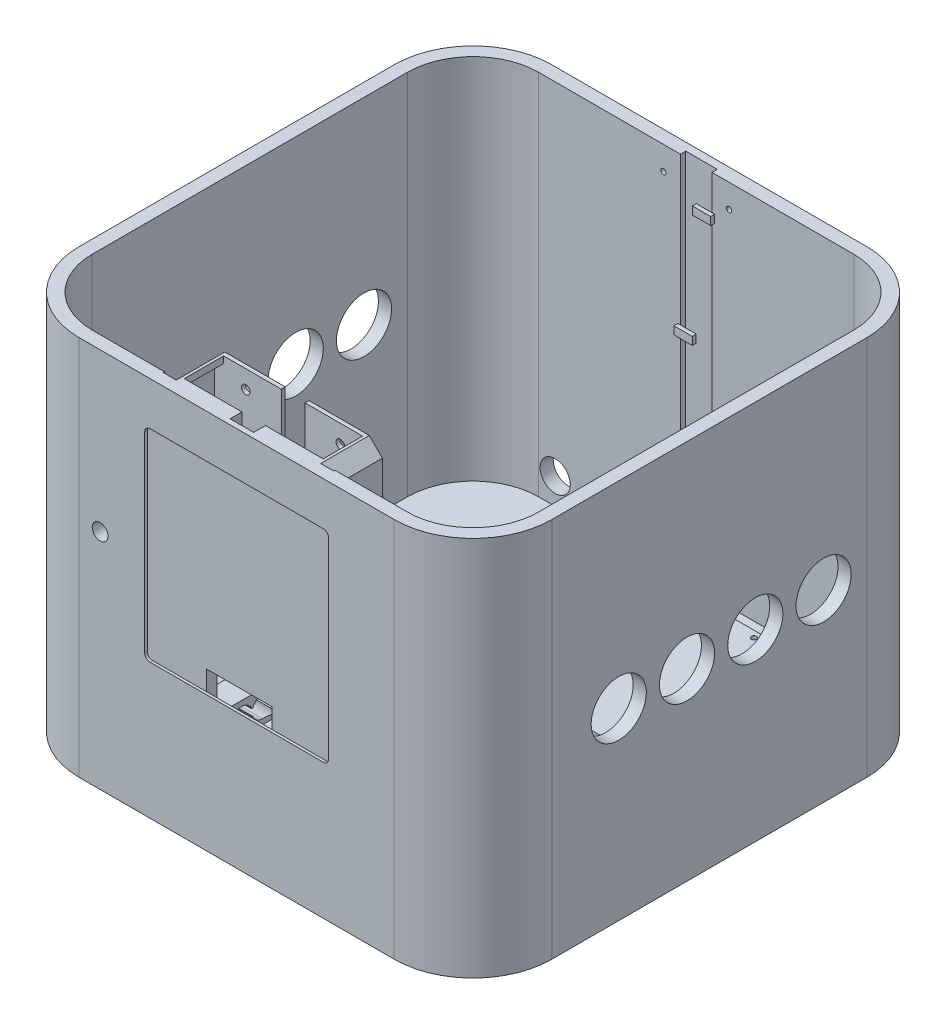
SolidWorks part; units mm, degrees
ref_plane "前视基准面" through (0, 0, 0) normal (0, 0, 1) x (1, 0, 0)
ref_plane "上视基准面" through (0, 0, 0) normal (0, 1, 0) x (1, 0, 0)
ref_plane "右视基准面" through (0, 0, 0) normal (1, 0, 0) x (0, 0, -1)
sketch "草图1" plane through (0, 0, 0) normal (0, 1, 0) x (1, 0, 0)
  line L1 (-90, -90) -> (90, -90)
  line L2 (-90, -90) -> (-90, 90)
  line L3 (-90, 90) -> (90, 90)
  line L4 (90, -90) -> (90, 90)
  line L5 (-90, -90) -> (90, 90) construction
  line L6 (-90, 90) -> (90, -90) construction
  point P0 (0, 0)
  dimension "D1" = 180
  dimension "D2" = 180
extrude "凸台-拉伸1" add sketch "草图1" along normal blind 180
fillet "圆角1" radius 30 4 edges at (90, 90, -90) (90, 90, 90) (-90, 90, 90) (-90, 90, -90)
sketch "草图2" plane through (0, 0, 0) normal (1, 0, 0) x (0, 0, -1)
  line L0 (-111.4699, 145) -> (109.0676, 145)
  line L1 (-60, 180) -> (60, 180) construction
  dimension "D1" = 35
surface "曲面-拉伸1" sketch "草图2" parameters "D1"=308
other "使用曲面切除1"
shell "抽壳2" thickness 5
sketch "草图3" plane through (0, 5, 0) normal (0, 1, 0) x (1, 0, 0)
  line L0 (-6.5, 85) -> (6.5, 85)
  line L1 (-6.5, 85) -> (-6.5, 60)
  line L2 (6.5, 85) -> (6.5, 60)
  line L3 (-6.5, 60) -> (6.5, 60)
  line L4 (60, 85) -> (-60, 85) construction
  point P6 (0, 85)
  dimension "D1" = 13
  dimension "D2" = 25
extrude "凸台-拉伸2" add sketch "草图3" along normal blind 3.5
sketch "草图4" plane through (0, 8.5, 0) normal (0, 1, 0) x (1, 0, 0)
  line L0 (0, -1000) -> (0, 49000) construction
  line L1 (6.5, 85) -> (-6.5, 85) construction
  circle A0 centre (0, 79.5) radius 2.75
  circle A1 centre (0, 64.5) radius 2.75
  dimension "D1" = 5.5
  dimension "D2" = 15
  dimension "D3" = 5.5
extrude "切除-拉伸1" cut sketch "草图4" against normal up to next
sketch "草图5" plane through (0, 0, 0) normal (0, -1, 0) x (1, 0, 0)
  line L0 (0, -1000) -> (0, 49000) construction
  line L13 (4.3301, -67) -> (4.3301, -62)
  line L14 (4.3301, -62) -> (0, -59.5)
  line L15 (0, -59.5) -> (-4.3301, -62)
  line L16 (-4.3301, -62) -> (-4.3301, -67)
  line L17 (-4.3301, -67) -> (0, -69.5)
  line L18 (0, -69.5) -> (4.3301, -67)
  line L19 (4.3301, -82) -> (4.3301, -77)
  line L20 (4.3301, -77) -> (0, -74.5)
  line L21 (0, -74.5) -> (-4.3301, -77)
  line L22 (-4.3301, -77) -> (-4.3301, -82)
  line L23 (-4.3301, -82) -> (0, -84.5)
  line L24 (0, -84.5) -> (4.3301, -82)
  circle A0 centre (0, -64.5) radius 5 construction
  circle A1 centre (0, -79.5) radius 5 construction
  dimension "D1" = 10
  dimension "D2" = 10
extrude "切除-拉伸2" cut sketch "草图5" against normal blind 4
sketch "草图6" plane through (0, 5, 0) normal (0, 1, 0) x (1, 0, 0)
  line L0 (11.5, 80) -> (64.5, 80) construction
  line L1 (11.5, 80) -> (11.5, 11) construction
  line L2 (64.5, 80) -> (64.5, 11) construction
  line L3 (11.5, 11) -> (64.5, 11) construction
  line L5 (6.5, 60) -> (6.5, 85) construction
  line L7 (-60, 85) -> (60, 85) construction
  circle A0 centre (29.5, 77.5) radius 1
  circle A1 centre (57, 77.5) radius 1
  circle A2 centre (62, 25) radius 1
  dimension "D5" = 2
  dimension "D1" = 53
  dimension "D2" = 69
  dimension "D3" = 5
  dimension "D4" = 2.5
  dimension "D6" = 2.5
  dimension "D7" = 18
  dimension "D8" = 27.5
  dimension "D9" = 14
  dimension "D10" = 5
sketch "草图7" plane through (0, 5, 0) normal (0, 1, 0) x (1, 0, 0)
  line L0 (11.5, 80) -> (64.5, 80)
  line L1 (11.5, 80) -> (11.5, 16.0952)
  line L2 (64.5, 80) -> (64.5, 16.0952)
  line L3 (11.5, 16.0952) -> (64.5, 16.0952)
extrude "凸台-拉伸3" add sketch "草图7" along normal blind 2
extrude "切除-拉伸6" cut sketch "草图6" along normal up to surface (2 mm away) and the other way blind 3
sketch "草图8" plane through (0, 8.5, 0) normal (0, 1, 0) x (1, 0, 0)
  line L0 (-6.5, 85) -> (6.5, 85)
  line L1 (-6.5, 85) -> (-6.5, 82.5)
  line L2 (6.5, 85) -> (6.5, 82.5)
  line L3 (-6.5, 82.5) -> (6.5, 82.5)
  dimension "D1" = 2.5
extrude "切除-拉伸7" cut sketch "草图8" against normal up to surface (3.5 mm away)
sketch "草图9" plane through (0, 5, 0) normal (0, 1, 0) x (1, 0, 0)
  line L0 (-49.5, 80) -> (-11.5, 80)
  line L1 (-49.5, 80) -> (-49.5, 45)
  line L2 (-11.5, 80) -> (-11.5, 45)
  line L3 (-49.5, 45) -> (-11.5, 45)
  line L4 (-60, 85) -> (60, 85) construction
  line L5 (-6.5, 82.5) -> (-6.5, 60) construction
  dimension "D3" = 5
  dimension "D1" = 38
  dimension "D2" = 35
  dimension "D4" = 5
extrude "凸台-拉伸5" add sketch "草图9" along normal blind 2
sketch "草图10" plane through (0, 7, 0) normal (0, 1, 0) x (1, 0, 0)
  line L0 (-49.5, 80) -> (-11.5, 45) construction
  line L1 (-11.5, 80) -> (-49.5, 45) construction
  line L3 (-45.5, 75) -> (-15.5, 75) construction
  line L4 (-45.5, 75) -> (-45.5, 50) construction
  line L5 (-45.5, 50) -> (-15.5, 50) construction
  line L6 (-15.5, 75) -> (-15.5, 50) construction
  line L7 (-45.5, 75) -> (-15.5, 50) construction
  line L8 (-45.5, 50) -> (-15.5, 75) construction
  circle A0 centre (-45.5, 75) radius 1
  circle A1 centre (-15.5, 75) radius 1
  circle A2 centre (-45.5, 50) radius 1
  circle A3 centre (-15.5, 50) radius 1
  point P8 (-30.5, 62.5)
  dimension "D3" = 2
  dimension "D1" = 30
  dimension "D2" = 25
extrude "切除-拉伸8" cut sketch "草图10" against normal blind 5
sketch "草图11" plane through (0, 5, 0) normal (0, 1, 0) x (1, 0, 0)
  line L0 (-49.5, 45) -> (-11.5, 45) construction
  line L1 (-44.5, 40) -> (-11.5, 40)
  line L2 (-44.5, 40) -> (-44.5, 2)
  line L3 (-44.5, 2) -> (-11.5, 2)
  line L4 (-11.5, 40) -> (-11.5, 2)
  line L5 (-44.5, 40) -> (-11.5, 2) construction
  line L6 (-44.5, 2) -> (-11.5, 40) construction
  line L7 (-49.5, 45) -> (-11.5, 45) construction
  line L8 (-11.5, 45) -> (-11.5, 80) construction
  point P0 (-28, 21)
  point P10 (-30.5, 45)
  dimension "D1" = 38
  dimension "D2" = 33
  dimension "D3" = 5
extrude "凸台-拉伸6" add sketch "草图11" along normal blind 2
sketch "草图12" plane through (0, 7, 0) normal (0, 1, 0) x (1, 0, 0)
  line L0 (-44.5, 40) -> (-11.5, 2) construction
  line L1 (-44.5, 2) -> (-11.5, 40) construction
  line L3 (-40.5, 36) -> (-15.5, 36) construction
  line L4 (-40.5, 36) -> (-40.5, 6) construction
  line L5 (-40.5, 6) -> (-15.5, 6) construction
  line L6 (-15.5, 36) -> (-15.5, 6) construction
  line L7 (-40.5, 36) -> (-15.5, 6) construction
  line L8 (-40.5, 6) -> (-15.5, 36) construction
  circle A0 centre (-40.5, 36) radius 1
  circle A1 centre (-15.5, 36) radius 1
  circle A2 centre (-15.5, 6) radius 1
  circle A3 centre (-40.5, 6) radius 1
  point P8 (-28, 21)
  dimension "D3" = 2
  dimension "D1" = 30
  dimension "D2" = 25
extrude "切除-拉伸9" cut sketch "草图12" against normal blind 5
sketch "草图13" plane through (0, 5, 0) normal (0, 1, 0) x (1, 0, 0)
  line L0 (-11.5, 40) -> (-44.5, 40) construction
  line L1 (-81.5, 40) -> (-49.5, 40)
  line L2 (-81.5, 40) -> (-81.5, 4)
  line L3 (-81.5, 4) -> (-49.5, 4)
  line L4 (-49.5, 40) -> (-49.5, 4)
  line L5 (-81.5, 40) -> (-49.5, 4) construction
  line L6 (-81.5, 4) -> (-49.5, 40) construction
  line L7 (-44.5, 40) -> (-44.5, 2) construction
  point P0 (-65.5, 22)
  dimension "D1" = 32
  dimension "D2" = 36
  dimension "D3" = 5
extrude "凸台-拉伸7" add sketch "草图13" along normal blind 2
sketch "草图14" plane through (0, 7, 0) normal (0, 1, 0) x (1, 0, 0)
  line L0 (-49.5, 40) -> (-81.5, 40) construction
  line L1 (-65.5, -960) -> (-65.5, 49040) construction
  line L2 (-49.5, 40) -> (-81.5, 40) construction
  circle A0 centre (-78, 36) radius 1
  circle A1 centre (-53, 36) radius 1
  point P12 (-65.5, 40)
  dimension "D1" = 2
  dimension "D2" = 2
  dimension "D3" = 4
  dimension "D4" = 25
  dimension "D5" = 12.5
extrude "切除-拉伸10" cut sketch "草图14" against normal blind 5
sketch "草图15" plane through (0, 0, 85) normal (0, 0, -1) x (-1, 0, 0)
  line L0 (-32.5, 145) -> (32.5, 145)
  line L1 (-32.5, 145) -> (-32.5, 70)
  line L2 (32.5, 145) -> (32.5, 70)
  line L3 (-32.5, 70) -> (32.5, 70)
  line L4 (60, 145) -> (-60, 145) construction
  point P6 (0, 145)
  dimension "D1" = 65
  dimension "D2" = 75
extrude "凸台-拉伸9" add sketch "草图15" along normal blind 18
ref_plane "基准面1" through (0, 0, 76) normal (0, 0, -1) x (-1, 0, 0)
sketch "草图17" plane through (0, 0, 76) normal (0, 0, -1) x (-1, 0, 0)
  line L0 (-32.5, 145) -> (-32.5, 140)
  line L1 (-32.5, 145) -> (-32.5, 70) construction
  line L2 (-32.5, 140) -> (-27.5, 145)
  line L3 (60, 145) -> (-60, 145) construction
  line L4 (-27.5, 145) -> (-32.5, 145)
  dimension "D1" = 5
  dimension "D2" = 5
extrude "切除-拉伸11" cut sketch "草图17" against normal mid plane 19
mirror "镜向1" about plane through (0, 0, 0) normal (1, 0, 0) of "切除-拉伸11"
sketch "草图18" plane through (0, 0, 76) normal (0, 0, -1) x (-1, 0, 0)
  line L0 (60, 145) -> (-60, 145) construction
  line L1 (32.5, 140) -> (27.5, 145) construction
  line L2 (32.5, 70) -> (32.5, 140) construction
  line L3 (-32.5, 70) -> (32.5, 70) construction
  line L4 (-32.5, 140) -> (-32.5, 70) construction
  line L5 (-32.5, 140) -> (-27.5, 145) construction
  line L6 (27.5, 145) -> (-27.5, 145) construction
  line L7 (32.5, 140) -> (27.5, 145) construction
  line L8 (32.5, 70) -> (32.5, 140) construction
  line L9 (-32.5, 70) -> (32.5, 70) construction
  line L10 (-32.5, 140) -> (-32.5, 70) construction
  line L11 (-32.5, 140) -> (-27.5, 145) construction
  line L12 (-30, 138.9645) -> (-26.4645, 142.5)
  line L13 (26.4645, 142.5) -> (-26.4645, 142.5) construction
  line L14 (30, 138.9645) -> (26.4645, 142.5)
  line L15 (30, 72.5) -> (30, 138.9645)
  line L16 (-30, 72.5) -> (30, 72.5) construction
  line L17 (-30, 138.9645) -> (-30, 72.5)
  line L18 (-26.4645, 142.5) -> (26.4645, 142.5) construction
  line L19 (-26.4645, 142.5) -> (-26.4645, 145.0257)
  line L20 (26.4645, 142.5) -> (26.4645, 145.0257)
  line L21 (-26.4645, 145.0257) -> (26.4645, 145.0257)
  line L22 (-30, 72.5) -> (30, 72.5) construction
  line L23 (-30, 72.5) -> (-30, 69.9528)
  line L24 (30, 72.5) -> (30, 69.9528)
  line L25 (-30, 69.9528) -> (30, 69.9528)
  dimension "D1" = 2.5
extrude "切除-拉伸12" cut sketch "草图18" against normal mid plane 15
sketch "草图19" plane through (0, 0, 83.5) normal (0, 0, -1) x (-1, 0, 0)
  line L0 (-18, 141.5) -> (-18, 134.7) construction
  line L1 (-15.0555, 136.4) -> (-15.0555, 139.8)
  line L2 (-15.0555, 139.8) -> (-18, 141.5)
  line L3 (-18, 141.5) -> (-20.9445, 139.8)
  line L4 (-20.9445, 139.8) -> (-20.9445, 136.4)
  line L5 (-20.9445, 136.4) -> (-18, 134.7)
  line L6 (-18, 134.7) -> (-15.0555, 136.4)
  line L7 (18, 134.7) -> (20.9445, 136.4)
  line L8 (20.9445, 136.4) -> (20.9445, 139.8)
  line L9 (20.9445, 139.8) -> (18, 141.5)
  line L10 (18, 141.5) -> (15.0555, 139.8)
  line L11 (15.0555, 139.8) -> (15.0555, 136.4)
  line L12 (15.0555, 136.4) -> (18, 134.7)
  line L13 (2.9445, 100.6) -> (2.9445, 104)
  line L14 (2.9445, 104) -> (0, 105.7)
  line L15 (0, 105.7) -> (-2.9445, 104)
  line L16 (-2.9445, 104) -> (-2.9445, 100.6)
  line L17 (-2.9445, 100.6) -> (0, 98.9)
  line L18 (0, 98.9) -> (2.9445, 100.6)
  line L19 (18, 141.5) -> (18, 134.7) construction
  line L20 (0, 105.7) -> (0, 98.9) construction
  line L21 (-18, 138.1) -> (18, 138.1) construction
  line L22 (0, -855) -> (0, 49145) construction
  line L23 (60, 145) -> (-60, 145) construction
  circle A0 centre (-18, 138.1) radius 3.4 construction
  circle A1 centre (18, 138.1) radius 3.4 construction
  circle A2 centre (0, 102.3) radius 3.4 construction
  point P17 (0, 138.1)
  point P30 (0, 145)
  dimension "D1" = 6.8
  dimension "D2" = 36
  dimension "D3" = 6.9
  dimension "D4" = 42.7
extrude "切除-拉伸13" cut sketch "草图19" against normal blind 2.5
sketch "草图20" plane through (0, 0, 67) normal (0, 0, -1) x (-1, 0, 0)
  line L0 (-2.9445, 104) -> (-2.9445, 100.6) construction
  line L1 (-2.9445, 100.6) -> (0, 98.9) construction
  line L2 (0, 98.9) -> (2.9445, 100.6) construction
  line L3 (2.9445, 100.6) -> (2.9445, 104) construction
  line L4 (2.9445, 104) -> (0, 105.7) construction
  line L5 (0, 105.7) -> (-2.9445, 104) construction
  line L6 (32.5, 70) -> (32.5, 140)
  line L7 (32.5, 140) -> (27.5, 145)
  line L8 (27.5, 145) -> (-27.5, 145)
  line L9 (-27.5, 145) -> (-32.5, 140)
  line L10 (-32.5, 140) -> (-32.5, 70)
  line L11 (-32.5, 70) -> (32.5, 70)
  line L12 (32.5, 70) -> (32.5, 140) construction
  line L13 (32.5, 140) -> (27.5, 145) construction
  line L14 (27.5, 145) -> (-27.5, 145) construction
  line L15 (-27.5, 145) -> (-32.5, 140) construction
  line L16 (-32.5, 140) -> (-32.5, 70) construction
  line L17 (-32.5, 70) -> (32.5, 70) construction
  line L18 (15.0555, 139.8) -> (15.0555, 136.4) construction
  line L19 (15.0555, 136.4) -> (18, 134.7) construction
  line L20 (18, 134.7) -> (20.9445, 136.4) construction
  line L21 (20.9445, 136.4) -> (20.9445, 139.8) construction
  line L22 (20.9445, 139.8) -> (18, 141.5) construction
  line L23 (18, 141.5) -> (15.0555, 139.8) construction
  line L24 (-20.9445, 139.8) -> (-20.9445, 136.4) construction
  line L25 (-20.9445, 136.4) -> (-18, 134.7) construction
  line L26 (-18, 134.7) -> (-15.0555, 136.4) construction
  line L27 (-15.0555, 136.4) -> (-15.0555, 139.8) construction
  line L28 (-15.0555, 139.8) -> (-18, 141.5) construction
  line L29 (-18, 141.5) -> (-20.9445, 139.8) construction
  line L30 (-2.9445, 104) -> (-2.9445, 100.6) construction
  line L31 (-2.9445, 100.6) -> (0, 98.9) construction
  line L32 (0, 98.9) -> (2.9445, 100.6) construction
  line L33 (2.9445, 100.6) -> (2.9445, 104) construction
  line L34 (2.9445, 104) -> (0, 105.7) construction
  line L35 (0, 105.7) -> (-2.9445, 104) construction
  line L36 (15.0555, 139.8) -> (15.0555, 136.4) construction
  line L37 (15.0555, 136.4) -> (18, 134.7) construction
  line L38 (18, 134.7) -> (20.9445, 136.4) construction
  line L39 (20.9445, 136.4) -> (20.9445, 139.8) construction
  line L40 (20.9445, 139.8) -> (18, 141.5) construction
  line L41 (18, 141.5) -> (15.0555, 139.8) construction
  line L42 (-20.9445, 139.8) -> (-20.9445, 136.4) construction
  line L43 (-20.9445, 136.4) -> (-18, 134.7) construction
  line L44 (-18, 134.7) -> (-15.0555, 136.4) construction
  line L45 (-15.0555, 136.4) -> (-15.0555, 139.8) construction
  line L46 (-15.0555, 139.8) -> (-18, 141.5) construction
  line L47 (-18, 141.5) -> (-20.9445, 139.8) construction
  line L48 (-18, 141.5) -> (-18, 134.7) construction
  line L49 (18, 141.5) -> (18, 134.7) construction
  line L50 (0, 105.7) -> (0, 98.9) construction
  circle A0 centre (-18, 138.1) radius 1.65
  circle A1 centre (18, 138.1) radius 1.65
  circle A2 centre (0, 102.3) radius 1.65
  dimension "D2" = 3.3
  dimension "D1" = 0
extrude "切除-拉伸17" cut sketch "草图20" against normal blind 2
sketch "草图22" plane through (0, 0, 90) normal (0, 0, 1) x (1, 0, 0)
  line L0 (-60, 0) -> (60, 0) construction
  line L1 (35, 128.5) -> (-35, 128.5)
  line L2 (35, 128.5) -> (35, 51.5)
  line L3 (35, 51.5) -> (-35, 51.5)
  line L4 (-35, 128.5) -> (-35, 51.5)
  line L5 (35, 128.5) -> (-35, 51.5) construction
  line L6 (35, 51.5) -> (-35, 128.5) construction
  point P0 (0, 90)
  dimension "D1" = 70
  dimension "D2" = 77
  dimension "D3" = 90
extrude "切除-拉伸18" cut sketch "草图22" against normal blind 1
sketch "草图23" plane through (0, 0, 89) normal (0, 0, 1) x (1, 0, 0)
  line L0 (-35, 51.5) -> (35, 51.5) construction
  line L1 (-12.5, 59) -> (12.5, 59)
  line L2 (-12.5, 59) -> (-12.5, 54)
  line L3 (-12.5, 54) -> (12.5, 54)
  line L4 (12.5, 59) -> (12.5, 54)
  line L5 (-12.5, 59) -> (12.5, 54) construction
  line L6 (-12.5, 54) -> (12.5, 59) construction
  point P0 (0, 56.5)
  dimension "D1" = 5
  dimension "D2" = 5
  dimension "D3" = 25
extrude "切除-拉伸19" cut sketch "草图23" against normal up to next
sketch "草图24" plane through (0, 0, -90) normal (0, 0, -1) x (-1, 0, 0)
  line L0 (-1049.9112, 136) -> (48950.0888, 136) construction
  line L1 (60, 145) -> (-60, 145) construction
  line L2 (0, -1000) -> (0, 49000) construction
  line L3 (-60, 0) -> (60, 0) construction
  line L4 (-12.5, 136) -> (12.5, 136) construction
  circle A0 centre (-12.5, 136) radius 1
  circle A1 centre (12.5, 136) radius 1
  point P4 (0, 136)
  point P5 (0, 0)
  point P18 (0, 0)
  dimension "D1" = 2
  dimension "D2" = 25
  dimension "D4" = 9
extrude "切除-拉伸20" cut sketch "草图24" against normal up to next
sketch "草图25" plane through (0, 0, -90) normal (0, 0, -1) x (-1, 0, 0)
  line L0 (-60, 5) -> (60, 5) construction
  circle A0 centre (53.6995, 15) radius 5.75
  dimension "D1" = 11.5
  dimension "D2" = 10
extrude "切除-拉伸21" cut sketch "草图25" against normal up to next
sketch "草图26" plane through (-90, 0, 0) normal (-1, 0, 0) x (0, 0, 1)
  line L0 (-974.4851, 70) -> (49025.5149, 70) construction
  line L1 (-60, 0) -> (60, 0) construction
  circle A0 centre (34.5035, 70) radius 10.5
  circle A1 centre (8.5035, 70) radius 10.5
  circle A2 centre (-17.4965, 70) radius 10.5
  circle A3 centre (-43.4965, 70) radius 10.5
  dimension "D1" = 21
  dimension "D2" = 26
  dimension "D3" = 26
  dimension "D4" = 26
  dimension "D5" = 70
extrude "切除-拉伸22" cut sketch "草图26" against normal up to next
mirror "镜向3" about plane through (0, 0, 0) normal (1, 0, 0) of "切除-拉伸22"
sketch "草图27" plane through (0, 54, 0) normal (0, 1, 0) x (1, 0, 0)
  line L4 (12.5, -85) -> (12.5, -89) construction
  line L5 (35, -89) -> (-35, -89) construction
  line L6 (32.5, -85) -> (-32.5, -85) construction
  line L7 (-12.5, -85) -> (-12.5, -89) construction
  line L12 (12.5, -85) -> (12.5, -89)
  line L13 (12.5, -89) -> (-12.5, -89)
  line L14 (12.5, -85) -> (-12.5, -85)
  line L15 (-12.5, -85) -> (-12.5, -89)
extrude "切除-拉伸23" cut sketch "草图27" against normal up to surface (49 mm away)
sketch "草图28" plane through (0, 145, 0) normal (0, 1, 0) x (1, 0, 0)
  line L0 (-6, 85) -> (6, 85)
  line L1 (-6, 85) -> (-6, 87)
  line L2 (6, 85) -> (6, 87)
  line L3 (-6, 87) -> (6, 87)
  line L4 (-60, 85) -> (60, 85) construction
  line L5 (0, -915) -> (0, 49085) construction
  point P7 (0, 85)
  point P9 (0, 85)
  dimension "D1" = 2
  dimension "D2" = 12
extrude "切除-拉伸24" cut sketch "草图28" against normal up to surface (140 mm away)
sketch "草图29" plane through (0, 0, 90) normal (0, 0, 1) x (1, 0, 0)
  line L0 (-35, 51.5) -> (60, 51.5) construction
  line L1 (60, 0) -> (60, 145) construction
  line L2 (-1032.5, 70) -> (48967.5, 70) construction
  line L3 (-60, 145) -> (-60, 0) construction
  circle A0 centre (-52, 85) radius 3
  dimension "D1" = 6
  dimension "D2" = 15
  dimension "D3" = 8
extrude "切除-拉伸25" cut sketch "草图29" against normal up to next
sketch "草图30" plane through (0, 145, 0) normal (0, 1, 0) x (1, 0, 0)
  line L0 (-27.5, -67) -> (27.5, -67) construction
  line L1 (-4.5, -67) -> (4.5, -67)
  line L2 (-4.5, -67) -> (-4.5, -88)
  line L3 (-4.5, -88) -> (4.5, -88)
  line L4 (4.5, -67) -> (4.5, -88)
  line L5 (-4.5, -67) -> (4.5, -88) construction
  line L6 (-4.5, -88) -> (4.5, -67) construction
  line L7 (0, -1000) -> (0, 49000) construction
  point P0 (0, -77.5)
  dimension "D1" = 9
  dimension "D2" = 21
extrude "切除-拉伸26" cut sketch "草图30" against normal blind 25
fillet "圆角2" radius 2 4 edges at (35, 51.5, 89.5) (-35, 128.5, 89.5) (-35, 51.5, 89.5) (35, 128.5, 89.5)
sketch "草图31" plane through (0, 0, -85) normal (0, 0, 1) x (1, 0, 0)
  line L0 (7, 131.6961) -> (7, 128.6961)
  line L1 (-7, 88.6734) -> (0, 88.6734)
  line L2 (-7, 88.6734) -> (-7, 85.6734)
  line L3 (-7, 85.6734) -> (0, 85.6734)
  line L5 (-7, 88.6734) -> (0, 87.1734) construction
  line L6 (-7, 85.6734) -> (0, 87.1734) construction
  line L7 (0, -1000) -> (0, 49000) construction
  line L12 (0, 131.6961) -> (7, 131.6961)
  line L13 (0, 128.6961) -> (7, 128.6961)
  line L15 (0, 38.9962) -> (7, 38.9962)
  line L16 (7, 38.9962) -> (7, 35.9962)
  line L17 (0, 35.9962) -> (7, 35.9962)
  line L19 (0, 38.9962) -> (0, 35.9962)
  line L20 (0, 88.6734) -> (0, 85.6734)
  line L21 (0, 131.6961) -> (0, 128.6961)
  point P0 (0, 87.1734)
extrude "凸台-拉伸10" add sketch "草图31" along normal blind 1.5
sketch "草图32" plane through (0, 0, 85) normal (0, 0, -1) x (-1, 0, 0)
  line L1 (36.5, 96) -> (67.5, 96) construction
  line L2 (36.5, 96) -> (36.5, 74) construction
  line L3 (36.5, 74) -> (67.5, 74) construction
  line L4 (67.5, 96) -> (67.5, 74) construction
  line L5 (36.5, 96) -> (67.5, 74) construction
  line L6 (36.5, 74) -> (67.5, 96) construction
  line L7 (67.5, 96) -> (59.0455, 96)
  line L8 (67.5, 96) -> (67.5, 90)
  line L9 (67.5, 90) -> (59.0455, 90)
  line L10 (59.0455, 96) -> (59.0455, 90)
  line L11 (67.5, 74) -> (59.0455, 74)
  line L12 (67.5, 74) -> (67.5, 80)
  line L13 (67.5, 80) -> (59.0455, 80)
  line L14 (59.0455, 74) -> (59.0455, 80)
  line L15 (48.5, 88.5) -> (55.5, 88.5)
  line L16 (48.5, 88.5) -> (48.5, 81.5)
  line L17 (48.5, 81.5) -> (55.5, 81.5)
  line L18 (55.5, 88.5) -> (55.5, 81.5)
  line L19 (48.5, 88.5) -> (55.5, 81.5) construction
  line L20 (48.5, 81.5) -> (55.5, 88.5) construction
  line L21 (46.5, 90.5) -> (57.5, 90.5)
  line L22 (46.5, 90.5) -> (46.5, 79.5)
  line L23 (46.5, 79.5) -> (57.5, 79.5)
  line L24 (57.5, 90.5) -> (57.5, 79.5)
  line L25 (46.5, 90.5) -> (57.5, 79.5) construction
  line L26 (46.5, 79.5) -> (57.5, 90.5) construction
  point P0 (52, 85)
  point P12 (52, 85)
  point P13 (52, 85)
  dimension "D1" = 31
  dimension "D2" = 22
  dimension "D3" = 6
  dimension "D4" = 6
  dimension "D5" = 7
  dimension "D6" = 7
  dimension "D7" = 11
  dimension "D8" = 11
extrude "凸台-拉伸11" add sketch "草图32" along normal blind 5.5
sketch "草图33" plane through (0, 0, 79.5) normal (0, 0, -1) x (-1, 0, 0)
  line L0 (-950.8123, 85) -> (49049.1877, 85) construction
  circle A0 centre (64.5, 92.75) radius 1
  circle A1 centre (64.5, 77.25) radius 1
  point P4 (52, 85)
  dimension "D1" = 2
  dimension "D2" = 15.5
  dimension "D3" = 12.5
extrude "切除-拉伸27" cut sketch "草图33" against normal blind 8
sketch "草图35" plane through (0, 0, 79.5) normal (0, 0, -1) x (-1, 0, 0)
  line L0 (57.5, 90.5) -> (46.5, 90.5) construction
  line L1 (46.5, 90.5) -> (52, 90.5)
  line L2 (46.5, 90.5) -> (46.5, 85)
  line L3 (46.5, 85) -> (52, 85)
  line L4 (52, 90.5) -> (52, 85)
  line L5 (46.5, 90.5) -> (46.5, 79.5) construction
extrude "切除-拉伸28" cut sketch "草图35" against normal blind 3
sketch "草图36" plane through (-32.5, 0, 0) normal (-1, 0, 0) x (0, 0, 1)
  line L0 (77.5, 91) -> (85, 79) construction
  line L1 (85, 79) -> (77.5, 79)
  line L2 (85, 79) -> (85, 91)
  line L3 (85, 91) -> (77.5, 91)
  line L4 (77.5, 79) -> (77.5, 91)
  line L5 (77.5, 79) -> (85, 91) construction
  line L7 (85, 90) -> (85, 80) construction
  point P5 (81.25, 85)
  point P12 (85, 85)
  dimension "D1" = 12
  dimension "D2" = 7.5
extrude "切除-拉伸29" cut sketch "草图36" against normal up to surface (2.5 mm away)
sketch "草图37" plane through (0, 5, 0) normal (0, 1, 0) x (1, 0, 0)
  line L0 (0, -1000) -> (0, 49000) construction
  line L1 (-47.4051, -35.6948) -> (-37.4051, -35.6948)
  line L2 (-47.4051, -35.6948) -> (-47.4051, -57.6948)
  line L3 (-47.4051, -57.6948) -> (-37.4051, -57.6948)
  line L4 (-37.4051, -35.6948) -> (-37.4051, -57.6948)
  line L5 (-47.4051, -35.6948) -> (-37.4051, -57.6948) construction
  line L6 (-47.4051, -57.6948) -> (-37.4051, -35.6948) construction
  line L7 (37.4051, -35.6948) -> (47.4051, -35.6948)
  line L8 (37.4051, -35.6948) -> (37.4051, -57.6948)
  line L9 (37.4051, -57.6948) -> (47.4051, -57.6948)
  line L10 (47.4051, -35.6948) -> (47.4051, -57.6948)
  line L11 (37.4051, -35.6948) -> (47.4051, -57.6948) construction
  line L12 (37.4051, -57.6948) -> (47.4051, -35.6948) construction
  point P0 (-42.4051, -46.6948)
  point P5 (42.4051, -46.6948)
  dimension "D1" = 10
  dimension "D2" = 22
  dimension "D3" = 10
  dimension "D4" = 22
extrude "凸台-拉伸12" add sketch "草图37" along normal blind 12
sketch "草图38" plane through (0, 0, 0) normal (1, 0, 0) x (0, 0, -1)
  line L1 (-35.6948, 17) -> (-35.6948, 5) construction
  line L2 (-1056.6948, 11) -> (48943.3052, 11) construction
  line L3 (-35.6948, 10) -> (-35.6948, 5)
  line L5 (-57.6948, 17) -> (-57.6948, 5) construction
  line L6 (-46.9448, 12.3919) -> (-46.4448, 12.3919)
  line L7 (-46.914, 9.6942) -> (-46.43, 9.5687)
  line L8 (-46.6948, 17) -> (-46.6948, 5) construction
  line L9 (-57.6948, 17) -> (-35.6948, 17) construction
  line L10 (-60, 5) -> (60, 5) construction
  arc A0 (-38.6948, 11) -> (-46.4448, 12.3919) centre (-42.6948, 11) ccw
  arc A1 (-46.9448, 12.3919) -> (-46.914, 9.6942) centre (-50.6948, 11) ccw
  arc A2 (-46.43, 9.5687) -> (-42.6948, 7) centre (-42.6948, 11) ccw
  spline S0 degree 2 poles (-42.6948, 7) (-38.8799, 7.1285) (-35.6948, 5) knots 0 0 0 1 1 1
  spline S1 degree 2 poles (-38.6948, 11) (-37.7512, 10.0849) (-35.6948, 10) knots 0.636809 0.636809 0.636809 1 1 1
  point P11 (-35.6948, 10)
  point P19 (-57.6948, 11)
  dimension "D1" = 8
  dimension "D2" = 8
  dimension "D3" = 5
  dimension "D4" = 0.5
  dimension "D5" = 0.5
extrude "切除-拉伸30" cut sketch "草图38" against normal mid plane 113
